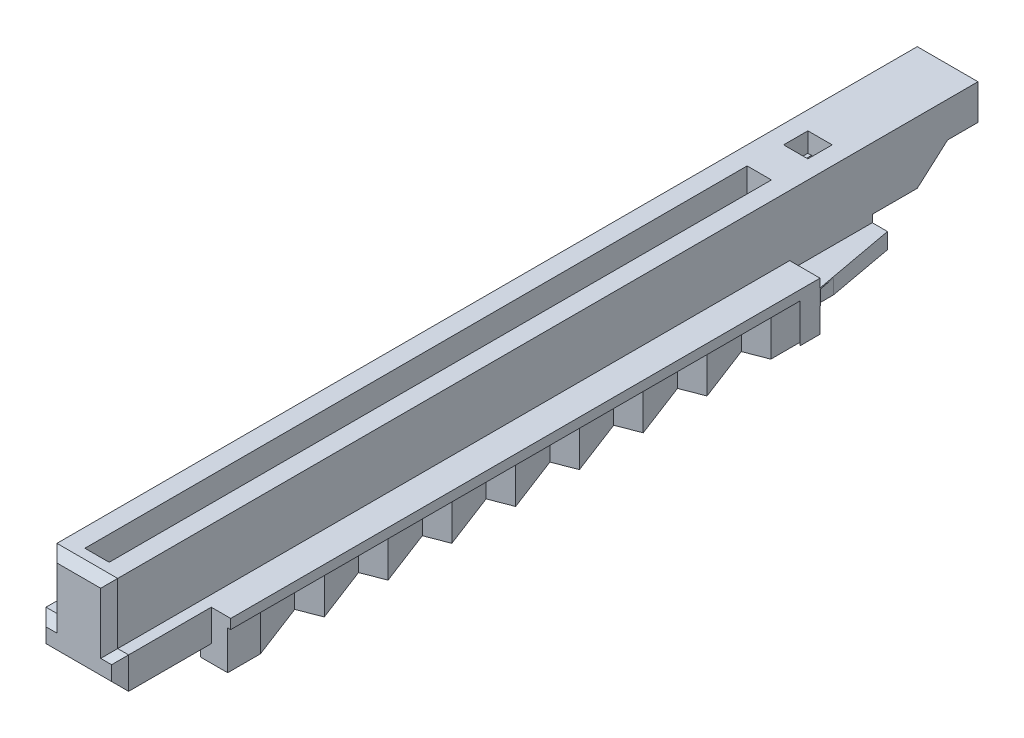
SolidWorks part; units mm, degrees
ref_plane "Plan1" through (0, 0, 0) normal (0, 0, 1) x (1, 0, 0)
ref_plane "Plan2" through (0, 0, 0) normal (0, 1, 0) x (1, 0, 0)
ref_plane "Plan3" through (0, 0, 0) normal (1, 0, 0) x (0, 0, -1)
sketch "Esquisse1" plane through (0, 0, 0) normal (0, 0, 1) x (1, 0, 0)
  line L1 (0, 0) -> (5, 0)
  line L2 (0, 0) -> (0, 7.6)
  line L3 (0, 7.6) -> (5, 7.6)
  line L4 (5, 0) -> (5, 7.6)
  dimension "D1" = 7.6
  dimension "D2" = 5
extrude "Base-Extrusion" add sketch "Esquisse1" along normal blind 71.5
sketch "Esquisse2" plane through (0, 7.6, 0) normal (0, 1, 0) x (-1, 0, 0)
  line L1 (-5, 71.5) -> (0, 71.5) construction
  line L2 (-3.5, 70) -> (-1.5, 70)
  line L3 (-3.5, 70) -> (-3.5, 15.5)
  line L4 (-3.5, 15.5) -> (-1.5, 15.5)
  line L5 (-1.5, 70) -> (-1.5, 15.5)
  line L6 (0, 71.5) -> (0, 0) construction
  line L7 (-5, 71.5) -> (-5, 0) construction
  dimension "D1" = 1.5
  dimension "D2" = 1.5
  dimension "D3" = 1.5
  dimension "D4" = 54.5
extrude "Enlèv. mat.-Extru.1" cut sketch "Esquisse2" against normal blind 4
sketch "Esquisse3" plane through (5, 0, 0) normal (1, 0, 0) x (0, 0, -1)
  line L0 (0, 0) -> (-8.7, 0)
  line L1 (-71.5, 0) -> (0, 0) construction
  line L2 (-8.7, 0) -> (-8.7, 2.5)
  line L3 (-8.7, 2.5) -> (-5, 2.5)
  line L4 (-5, 2.5) -> (-2.5, 4.7)
  line L5 (-2.5, 4.7) -> (0, 4.7)
  line L6 (0, 4.7) -> (0, 0)
  line L7 (-71.5, 7.6) -> (0, 7.6) construction
  dimension "D1" = 2.5
  dimension "D2" = 8.7
  dimension "D3" = 2.9
  dimension "D4" = 2.5
extrude "Enlèv. mat.-Extru.2" cut sketch "Esquisse3" against normal through all
sketch "Esquisse4" plane through (0, 0, 0) normal (0, -1, 0) x (1, 0, 0)
  line L0 (0, 0) -> (5, 0) construction
  line L1 (4.5, 0) -> (0.5, 0)
  line L2 (4.5, 0) -> (4.5, 10.45)
  line L3 (4.5, 13.6) -> (0.5, 13.6)
  line L4 (0.5, 0) -> (0.5, 10.45)
  line L6 (4.5, 11.85) -> (3.2, 11.85)
  line L7 (3.2, 11.85) -> (3.2, 10.45)
  line L8 (3.2, 10.45) -> (4.5, 10.45)
  line L9 (0.5, 11.85) -> (1.8, 11.85)
  line L10 (1.8, 11.85) -> (1.8, 10.45)
  line L11 (1.8, 10.45) -> (0.5, 10.45)
  line L12 (4.5, 11.85) -> (4.5, 13.6)
  line L13 (0.5, 11.85) -> (0.5, 13.6)
  dimension "D2" = 4
  dimension "D4" = 1.75
  dimension "D6" = 1.4
extrude "Enlèv. mat.-Extru.3" cut sketch "Esquisse4" against normal blind 6
sketch "Esquisse8" plane through (0, 0, 71.5) normal (0, 0, 1) x (1, 0, 0)
  line L0 (5, 7.6) -> (0, 7.6) construction
  line L1 (-2.5, 2.6) -> (7.5, 2.6)
  line L2 (-2.5, 2.6) -> (-2.5, -1.4)
  line L3 (-2.5, -1.4) -> (7.5, -1.4)
  line L4 (7.5, 2.6) -> (7.5, -1.4)
  line L5 (0, 7.6) -> (0, 0) construction
  dimension "D1" = 5
  dimension "D2" = 4
  dimension "D3" = 2.5
  dimension "D4" = 10
extrude "Boss.-Extru.1" add sketch "Esquisse8" against normal blind 56
sketch "Esquisse9" plane through (0, -1.4, 0) normal (0, -1, 0) x (1, 0, 0)
  line L0 (-2.5, 71.5) -> (7.5, 71.5) construction
  line L1 (0, 71.5) -> (5, 71.5)
  line L2 (0, 71.5) -> (0, 15.5)
  line L3 (0, 15.5) -> (5, 15.5)
  line L4 (5, 71.5) -> (5, 15.5)
  line L5 (-2.5, 15.5) -> (7.5, 15.5) construction
  line L6 (-2.5, 15.5) -> (-2.5, 71.5) construction
  dimension "D1" = 5
  dimension "D2" = 2.5
  dimension "D3" = 56
extrude "Enlèv. mat.-Extru.7" cut sketch "Esquisse9" against normal blind 1.4
sketch "Esquisse10" plane through (0, 0, 0) normal (0, -1, 0) x (1, 0, 0)
  line L0 (5, 71.5) -> (7.5, 71.5) construction
  line L1 (3.5, 69.75) -> (1.5, 69.75)
  line L2 (3.5, 69.75) -> (3.5, 66.868)
  line L3 (3.5, 15.75) -> (1.5, 15.75)
  line L4 (1.5, 69.75) -> (1.5, 66.868)
  line L5 (5, 71.5) -> (0, 71.5) construction
  line L6 (5, 15.5) -> (5, 71.5) construction
  line L7 (0, 71.5) -> (0, 15.5) construction
  line L9 (3.5, 18.632) -> (3.5, 15.75)
  line L10 (1.5, 18.632) -> (1.5, 15.75)
  line L11 (3.5, 41.632) -> (3.5, 20.868)
  line L12 (1.5, 41.632) -> (1.5, 20.868)
  line L13 (3.5, 64.632) -> (3.5, 43.868)
  line L14 (1.5, 64.632) -> (1.5, 43.868)
  arc A0 (1.5, 66.868) -> (1.5, 64.632) centre (2.5, 65.75) ccw
  arc A1 (1.5, 43.868) -> (1.5, 41.632) centre (2.5, 42.75) ccw
  arc A2 (1.5, 20.868) -> (1.5, 18.632) centre (2.5, 19.75) ccw
  arc A3 (3.5, 18.632) -> (3.5, 20.868) centre (2.5, 19.75) ccw
  arc A4 (3.5, 41.632) -> (3.5, 43.868) centre (2.5, 42.75) ccw
  arc A5 (3.5, 64.632) -> (3.5, 66.868) centre (2.5, 65.75) ccw
  dimension "D7" = 3
  dimension "D9" = 3
  dimension "D13" = 3
  dimension "D1" = 54
  dimension "D2" = 1.75
  dimension "D3" = 1.5
  dimension "D4" = 1.5
  dimension "D5" = 4
  dimension "D6" = 1
  dimension "D8" = 27
  dimension "D10" = 1
  dimension "D11" = 4
  dimension "D12" = 1
extrude "Enlèv. mat.-Extru.8" cut sketch "Esquisse10" against normal blind 2
sketch "Esquisse12" plane through (0, -1.4, 0) normal (0, -1, 0) x (1, 0, 0)
  line L1 (7.5, 71.5) -> (5.9, 71.5)
  line L2 (7.5, 71.5) -> (7.5, 64)
  line L3 (7.5, 64) -> (5.9, 64)
  line L4 (5.9, 71.5) -> (5.9, 64)
  dimension "D1" = 7.5
  dimension "D2" = 1.6
extrude "Enlèv. mat.-Extru.10" cut sketch "Esquisse12" against normal through all
sketch "Esquisse13" plane through (0, -1.4, 0) normal (0, -1, 0) x (1, 0, 0)
  line L1 (-2.5, 71.5) -> (-0.9, 71.5)
  line L2 (-2.5, 71.5) -> (-2.5, 64.2)
  line L3 (-2.5, 64.2) -> (-0.9, 64.2)
  line L4 (-0.9, 71.5) -> (-0.9, 64.2)
  dimension "D1" = 1.6
  dimension "D2" = 7.3
extrude "Enlèv. mat.-Extru.11" cut sketch "Esquisse13" against normal through all
sketch "Esquisse14" plane through (0, -1.4, 0) normal (0, -1, 0) x (1, 0, 0)
  line L1 (-0.9, 71.5) -> (0, 71.5)
  line L2 (-0.9, 71.5) -> (-0.9, 66.5)
  line L3 (-0.9, 66.5) -> (0, 66.5)
  line L4 (0, 71.5) -> (0, 66.5)
  dimension "D1" = 5
extrude "Enlèv. mat.-Extru.12" cut sketch "Esquisse14" against normal up to surface (1.4 mm away)
sketch "Esquisse15" plane through (0, -1.4, 0) normal (0, -1, 0) x (1, 0, 0)
  line L1 (5, 71.5) -> (5.9, 71.5)
  line L2 (5, 71.5) -> (5, 64)
  line L3 (5, 64) -> (5.9, 64)
  line L4 (5.9, 71.5) -> (5.9, 64)
extrude "Enlèv. mat.-Extru.13" cut sketch "Esquisse15" against normal up to surface (1.4 mm away)
chamfer "Chanfrein1" distance 0.7 angle 45
sketch "Esquisse16" plane through (0, 0, 15.5) normal (0, 0, -1) x (-1, 0, 0)
  line L0 (0, 2.5) -> (0, 0) construction
  line L1 (0, 1.9) -> (2.5, 1.9)
  line L2 (0, 1.9) -> (0, 0.6)
  line L3 (0, 0.6) -> (2.5, 0.6)
  line L4 (2.5, 1.9) -> (2.5, 0.6)
  line L5 (2.5, 2.6) -> (2.5, -1.4) construction
  line L6 (-5, 7.6) -> (0, 7.6) construction
  dimension "D1" = 1.3
  dimension "D2" = 7
extrude "Boss.-Extru.2" add sketch "Esquisse16" along normal up to surface (6.8 mm away)
sketch "Esquisse17" plane through (0, 0, 15.5) normal (0, 0, -1) x (-1, 0, 0)
  line L1 (-7.5, -1.4) -> (-7.5, 2.6) construction
  line L2 (-7.5, 1.9) -> (-5, 1.9)
  line L3 (-7.5, 1.9) -> (-7.5, 0.6)
  line L4 (-7.5, 0.6) -> (-5, 0.6)
  line L6 (-5, 1.9) -> (-5, 0.6)
  line L7 (-5, 7.6) -> (0, 7.6) construction
  dimension "D1" = 1.3
  dimension "D2" = 7
extrude "Boss.-Extru.3" add sketch "Esquisse17" along normal up to surface (6.8 mm away)
sketch "Esquisse18" plane through (0, 1.9, 0) normal (0, 1, 0) x (-1, 0, 0)
  line L0 (-7.5, 15.5) -> (-6.25, 8.7)
  line L1 (-7.5, 8.7) -> (-5, 8.7) construction
  line L2 (-6.25, 8.7) -> (-9, 8)
  line L3 (-9, 8) -> (-9, 15)
  line L4 (-9, 15) -> (-7.5, 15.5)
  line L6 (-5, 70.8) -> (-5, 0) construction
  dimension "D1" = 1.25
extrude "Enlèv. mat.-Extru.14" cut sketch "Esquisse18" against normal through all
sketch "Esquisse19" plane through (0, 1.9, 0) normal (0, 1, 0) x (-1, 0, 0)
  line L0 (2.5, 15.5) -> (1.25, 8.7)
  line L1 (0, 8.7) -> (2.5, 8.7) construction
  line L2 (1.25, 8.7) -> (4.0002, 8.1944)
  line L3 (4.0002, 8.1944) -> (4.1538, 14.2812)
  line L4 (4.1538, 14.2812) -> (2.5, 15.5)
  line L5 (0, 70.8) -> (0, 0) construction
  dimension "D1" = 1.25
extrude "Enlèv. mat.-Extru.15" cut sketch "Esquisse19" against normal through all
sketch "Esquisse20" plane through (0, -1.4, 0) normal (0, -1, 0) x (1, 0, 0)
  line L0 (7.25, 61.3) -> (5.4935, 56.7242)
  line L1 (5.4935, 56.7242) -> (7.25, 56.05)
  line L3 (5, 64) -> (7.5, 64) construction
  line L4 (7.5, 15.5) -> (7.5, 64) construction
  line L5 (7.25, 56.05) -> (5.4935, 51.4742)
  line L6 (7.25, 45.55) -> (7.25, 50.8)
  line L7 (5.4935, 51.4742) -> (7.25, 50.8)
  line L8 (7.25, 50.8) -> (5.4935, 46.2242)
  line L9 (7.25, 40.3) -> (7.25, 45.55)
  line L10 (5.4935, 46.2242) -> (7.25, 45.55)
  line L11 (7.25, 45.55) -> (5.4935, 40.9742)
  line L12 (7.25, 35.05) -> (7.25, 40.3)
  line L13 (5.4935, 40.9742) -> (7.25, 40.3)
  line L14 (7.25, 40.3) -> (5.4935, 35.7242)
  line L15 (7.25, 29.8) -> (7.25, 35.05)
  line L16 (5.4935, 35.7242) -> (7.25, 35.05)
  line L17 (7.25, 35.05) -> (5.4935, 30.4742)
  line L18 (7.25, 24.55) -> (7.25, 29.8)
  line L19 (5.4935, 30.4742) -> (7.25, 29.8)
  line L20 (7.25, 29.8) -> (5.4935, 25.2242)
  line L21 (7.25, 19.3) -> (7.25, 24.55)
  line L22 (5.4935, 25.2242) -> (7.25, 24.55)
  line L23 (7.25, 24.55) -> (5.4935, 19.9742)
  line L24 (7.25, 56.05) -> (7.25, 61.3)
  line L25 (5.4935, 19.9742) -> (7.25, 19.3)
  line L26 (7.25, 61.3) -> (7.25, 64)
  line L27 (7.25, 64) -> (7.5, 64)
  line L28 (7.25, 19.3) -> (7.25, 14.14)
  line L29 (6.25, 8.7) -> (7.5, 15.5) construction
  line L30 (7.25, 14.14) -> (7.4896, 15.4432)
  line L31 (7.5, 64) -> (7.5, 58.1509)
  line L32 (7.5, 58.1509) -> (7.5, 57.6262)
  line L33 (7.5, 57.6262) -> (7.5, 55.5073)
  line L34 (7.5, 55.5073) -> (7.5, 53.1058)
  line L35 (7.5, 53.1058) -> (7.5, 50.8)
  line L36 (7.5, 50.8) -> (7.5, 48.2927)
  line L37 (7.5, 48.2927) -> (7.5, 45.8206)
  line L38 (7.5, 45.8206) -> (7.5, 43.5201)
  line L39 (7.5, 43.5201) -> (7.5, 41.2498)
  line L40 (7.5, 41.2498) -> (7.5, 39.04)
  line L41 (7.5, 39.04) -> (7.5, 36.7092)
  line L42 (7.5, 36.7092) -> (7.5, 34.4792)
  line L43 (7.5, 34.4792) -> (7.5, 32.2493)
  line L44 (7.5, 32.2493) -> (7.5, 29.8982)
  line L45 (7.5, 29.8982) -> (7.5, 27.6582)
  line L46 (7.5, 27.6582) -> (7.5, 25.3778)
  line L47 (7.5, 25.3778) -> (7.5, 23.1882)
  line L48 (7.5, 23.1882) -> (7.5, 21.2307)
  line L49 (7.5, 21.2307) -> (7.5, 19.3842)
  line L50 (7.5, 19.3842) -> (7.5, 17.1341)
  line L51 (7.5, 17.1341) -> (7.4896, 15.4432)
  line L52 (7.25, 50.8) -> (7.25, 56.05)
  dimension "D1" = 2.7
  dimension "D3" = 5.25
extrude "Enlèv. mat.-Extru.16" cut sketch "Esquisse20" against normal blind 3.2
sketch "Esquisse21" plane through (0, -1.4, 0) normal (0, -1, 0) x (1, 0, 0)
  line L1 (-0.5, 62.7316) -> (-2.25, 58.15)
  line L3 (-0.5, 62.7316) -> (-2.25, 63.4)
  line L4 (5.4935, 51.4742) -> (7.25, 50.8) construction
  line L6 (-2.5, 64.2) -> (-0.9, 64.2) construction
  line L7 (-0.5, 57.4816) -> (-2.25, 58.15)
  line L8 (-2.5, 64.2) -> (-2.5, 45.2472)
  line L9 (-0.5, 57.4816) -> (-2.25, 52.9)
  line L10 (-0.5, 52.2316) -> (-2.25, 52.9)
  line L12 (-0.5, 52.2316) -> (-2.25, 47.65)
  line L13 (-0.5, 46.9816) -> (-2.25, 47.65)
  line L15 (-0.5, 46.9816) -> (-2.25, 42.4)
  line L16 (-0.5, 41.7316) -> (-2.25, 42.4)
  line L18 (-0.5, 41.7316) -> (-2.25, 37.15)
  line L19 (-0.5, 36.4816) -> (-2.25, 37.15)
  line L21 (-0.5, 36.4816) -> (-2.25, 31.9)
  line L22 (-0.5, 31.2316) -> (-2.25, 31.9)
  line L24 (-0.5, 31.2316) -> (-2.25, 26.65)
  line L25 (-0.5, 25.9816) -> (-2.25, 26.65)
  line L26 (-0.5, 25.9816) -> (-2.25, 21.4)
  line L28 (-2.25, 21.4) -> (-2.25, 14.2823)
  line L29 (-2.25, 14.2823) -> (-2.5, 15.5)
  line L30 (-2.5, 15.5) -> (-2.5, 64.2) construction
  line L31 (-2.25, 63.4) -> (-2.25, 64.2)
  line L32 (-2.25, 64.2) -> (-2.5, 64.2)
  line L33 (-2.5, 45.2472) -> (-2.5, 15.5)
  line L44 (-2.25, 21.4) -> (-2.25, 26.65)
  line L45 (-2.25, 26.65) -> (-2.25, 31.9)
extrude "Enlèv. mat.-Extru.17" cut sketch "Esquisse21" against normal blind 3.2
sketch "Esquisse22" plane through (0, 7.6, 0) normal (0, 1, 0) x (-1, 0, 0)
  line L0 (-1.5, 15.5) -> (-1.5, 70) construction
  line L1 (-3.5, 12.5) -> (-1.5, 12.5)
  line L2 (-3.5, 12.5) -> (-3.5, 10.5)
  line L3 (-3.5, 10.5) -> (-1.5, 10.5)
  line L4 (-1.5, 12.5) -> (-1.5, 10.5)
  line L5 (-3.5, 15.5) -> (-1.5, 15.5) construction
  dimension "D1" = 2
  dimension "D2" = 2
  dimension "D3" = 2
  dimension "D4" = 3
extrude "Enlèv. mat.-Extru.18" cut sketch "Esquisse22" against normal blind 1.6
